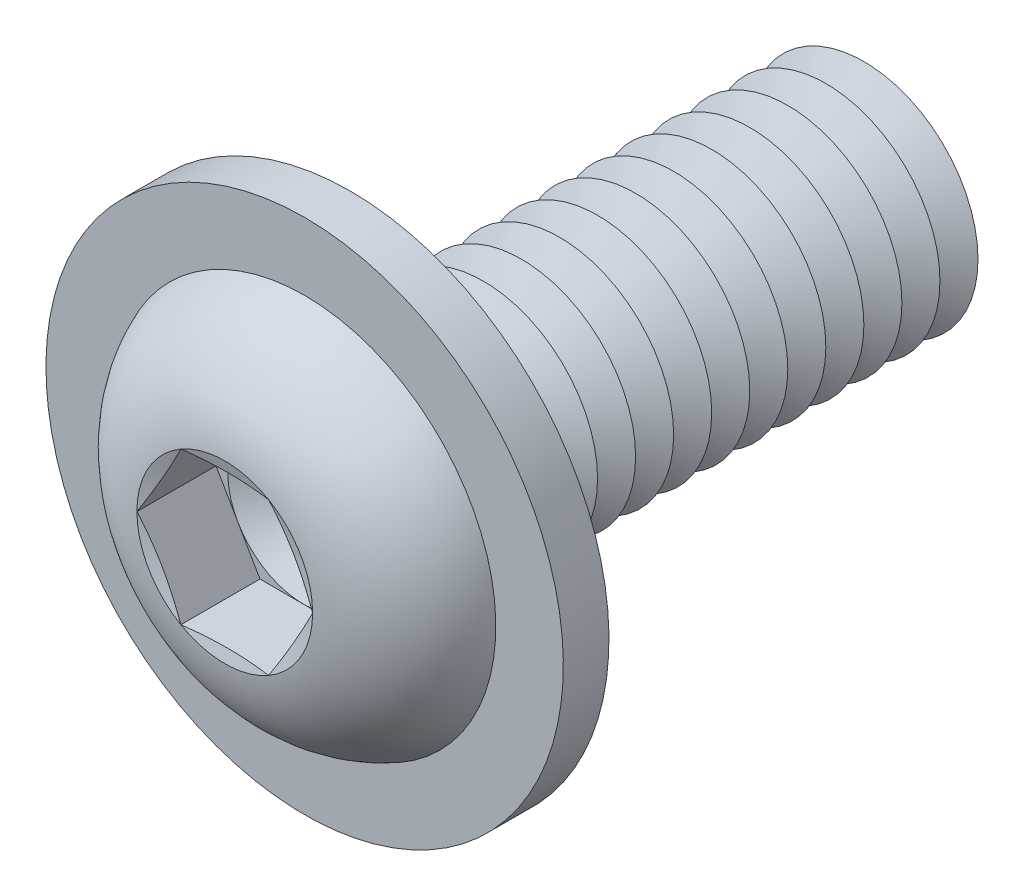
SolidWorks part; units mm, degrees
ref_plane "Front Plane" through (0, 0, 0) normal (0, 0, 1) x (1, 0, 0)
ref_plane "Top Plane" through (0, 0, 0) normal (0, 1, 0) x (1, 0, 0)
ref_plane "Right Plane" through (0, 0, 0) normal (1, 0, 0) x (0, 0, -1)
sketch "Sketch1" plane through (0, 0, 0) normal (1, 0, 0) x (0, 0, -1)
  line L0 (0, 3) -> (0, 5.25)
  line L3 (0, 3) -> (14, 3)
  line L4 (14, 3) -> (14, 0)
  line L5 (14, 0) -> (-3.3, 0) construction
  line L6 (-3.3, 0) -> (14, 0)
  line L7 (-3.3, 2.3094) -> (-3.3, 1.1547) construction
  line L8 (-3.3, 1.1547) -> (-3.3, 0)
  line L9 (-3.3, 2.3094) -> (-2.9906, 1.1547)
  line L10 (-2.9906, 1.1547) -> (-3.3, 1.1547)
  line L11 (14, 0) -> (22.7481, 0) construction
  line L12 (0, 5.25) -> (-3.3, 5.25) construction
  arc A1 (0, 5.25) -> (-3.3, 2.3094) centre (0, 1.928) ccw
  point P8 (14, 1.5)
  dimension "D1" = 10.5
  dimension "D2" = 6
  dimension "D3" = 3.3
  dimension "D4" = 4.6188
  dimension "D5" = 14
  dimension "D6" = 15
revolve "Revolve1" add sketch "Sketch1" angle 360 about L5
fillet "Fillet1" radius 0.5 1 edges at (-3, 0, 0)
sketch "Sketch2" plane through (0, 0, 0) normal (1, 0, 0) x (0, 0, -1)
  line L0 (13.5, 3) -> (14.5, 3)
  line L1 (14, 3) -> (0.5, 3) construction
  line L2 (14.5, 3) -> (14, 2.134)
  line L3 (14, -3) -> (14, 3) construction
  line L4 (14, 2.134) -> (13.5, 3)
  dimension "D1" = 1
revolve "Cut-Revolve1" cut sketch "Sketch2" angle 360 about axis through (0, 0, -14) along (0, 0, -1)
pattern_linear "LPattern1" count 14 spacing 1 along (0, 0, 1) of "Cut-Revolve1"
sketch "Sketch3" plane through (0, 0, 3.3) normal (0, 0, 1) x (1, 0, 0)
  line L7 (1.1547, 2) -> (-1.1547, 2)
  line L8 (-1.1547, 2) -> (-2.3094, 0)
  line L9 (-2.3094, 0) -> (-1.1547, -2)
  line L10 (-1.1547, -2) -> (1.1547, -2)
  line L11 (1.1547, -2) -> (2.3094, 0)
  line L12 (2.3094, 0) -> (1.1547, 2)
  circle A0 centre (0, 0) radius 2 construction
  circle A3 centre (0, 0) radius 2.3094 construction
extrude "Cut-Extrude1" cut sketch "Sketch3" against normal blind 2.08
sketch "Sketch4" plane through (0, 0, 1.22) normal (0, 0, 1) x (1, 0, 0)
  line L1 (1.1547, 2) -> (-1.1547, 2) construction
  circle A0 centre (0, 0) radius 2
extrude "Cut-Extrude2" cut sketch "Sketch4" against normal through all draft 60
sketch "Sketch5" plane through (0, 0, 0) normal (0, 0, -1) x (-1, 0, 0)
  circle A0 centre (0, 0) radius 6.8
  circle A1 centre (0, 0) radius 3.5
  circle A2 centre (0, 0) radius 3.5 construction
  dimension "D1" = 13.6
extrude "Boss-Extrude1" add sketch "Sketch5" against normal blind 1.2
